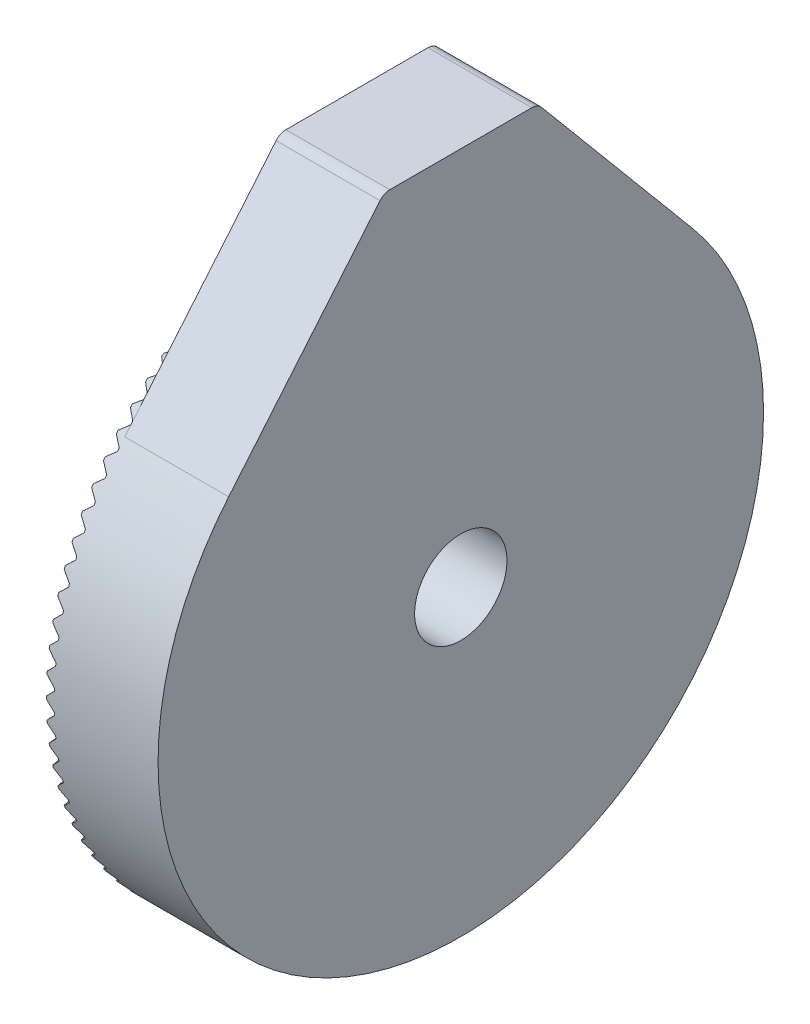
SolidWorks part; units mm, degrees
ref_plane "Plan1" through (0, 0, 0) normal (0, 0, 1) x (1, 0, 0)
ref_plane "Plan2" through (0, 0, 0) normal (0, 1, 0) x (1, 0, 0)
ref_plane "Plan3" through (0, 0, 0) normal (1, 0, 0) x (0, 0, -1)
sketch "Esquisse2" plane through (0, 0, 0) normal (0, 0, 1) x (1, 0, 0)
  line L0 (-2.8304, -1.8) -> (-6.5804, -1.8)
  line L1 (-6.5804, -1.8) -> (-6.5804, -3.5)
  line L2 (-6.5804, -3.5) -> (-9.93, -3.5)
  line L3 (-9.93, -3.5) -> (-9.93, -5)
  line L4 (-9.93, -5) -> (-4.3304, -5)
  line L5 (-4.3304, -5) -> (-4.3304, -10.3)
  line L6 (-4.3304, -10.3) -> (-7.1281, -10.3)
  line L7 (-7.1281, -10.3) -> (-7.1804, -11.8)
  line L8 (-7.1804, -11.8) -> (-2.8304, -11.8)
  line L9 (-2.8304, -11.8) -> (-2.8304, -1.8)
  line L10 (0, 0) -> (-13.3361, 0) construction
  dimension "D1" = 1.8
  dimension "D2" = 3.5
  dimension "D3" = 9.93
  dimension "D4" = 5
  dimension "D5" = 1.5
  dimension "D6" = 2.8304
  dimension "D7" = 90
  dimension "D8" = 7.1804
  dimension "D9" = 4.3304
  dimension "D10" = 6.8
  dimension "D11" = 5.3
  dimension "D12" = 88
  dimension "D13" = 10
  dimension "D14" = 3.75
revolve "Base-Révolution" add sketch "Esquisse2" angle 360 about L10
sketch "Esquisse3" plane through (-2.8304, 0, 0) normal (1, 0, 0) x (0, 0, -1)
  line L0 (16.8087, 0) -> (-17.0319, 0) construction
  line L1 (0, 18.7425) -> (0, -16.1394) construction
  line L2 (-2.7665, 14.8) -> (2.7665, 14.8)
  line L3 (3.1499, 14.6209) -> (9.0485, 7.574)
  line L4 (-3.1499, 14.6209) -> (-9.0485, 7.574)
  line L6 (9.0485, 7.574) -> (7.2722, 7.574)
  line L7 (-7.2722, 7.574) -> (-9.0485, 7.574)
  arc A0 (7.2722, 7.574) -> (-7.2722, 7.574) centre (0, 0) ccw
  circle A1 centre (0, 0) radius 11.8 construction
  arc A2 (2.7665, 14.8) -> (3.1499, 14.6209) centre (2.7665, 14.3) cw
  arc A3 (-3.1499, 14.6209) -> (-2.7665, 14.8) centre (-2.7665, 14.3) cw
  point P15 (0, 14.8)
  point P17 (3, 14.8)
  point P20 (-3, 14.8)
  dimension "D1" = 21
  dimension "D5" = 0.5
  dimension "D2" = 14.8
  dimension "D3" = 6
  dimension "D4" = 7.574
extrude "Boss.-Extru.1" add sketch "Esquisse3" against normal blind 4.05
ref_plane "Plan5" through (0, 11.8, 0) normal (0, 1, 0) x (-1, 0, 0)
ref_plane "Plan6" through (0, 5.9, 0) normal (0, 1, 0) x (-1, 0, 0)
sketch "Esquisse10" plane through (0, 11.8, 0) normal (0, 1, 0) x (-1, 0, 0)
  line L0 (7.6823, 0.8568) -> (7.6823, -0.8568)
  line L2 (0, 0) -> (13.3361, 0) construction
  line L3 (6.8804, 0.055) -> (6.8804, -0.055)
  line L4 (7.1804, 0.6768) -> (7.1804, -1.0628) construction
  line L5 (10.165, 0) -> (5.0728, 0) construction
  line L6 (6.8804, -2.7665) -> (6.8804, 2.7665) construction
  line L7 (7.1804, -11.8) -> (7.1804, 11.8) construction
  line L8 (6.8804, 0.055) -> (7.6823, 0.8568)
  line L9 (6.8804, -0.055) -> (7.6823, -0.8568)
  point P11 (6.8804, 0)
  point P12 (7.5624, 0)
  point P17 (6.8804, 0)
  dimension "D1" = 0.11
  dimension "D2" = 45
extrude "Enlèv. mat.-Extru.1" cut sketch "Esquisse10" against normal blind 5
pattern_circular "Répétition circulaire2" count 90 every 4 about axis through (0, 0, 0) along (-1, 0, 0)
sketch "Esquisse11" plane through (-2.8304, 0, 0) normal (1, 0, 0) x (0, 0, -1)
  line L0 (0, 0) -> (0, 31.8446) construction
